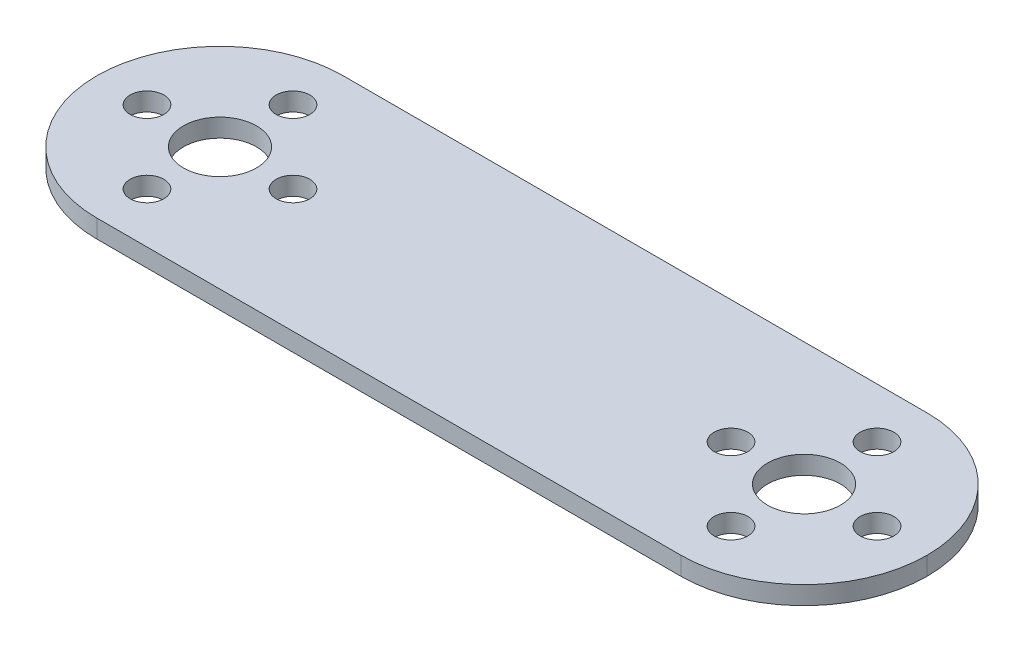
SolidWorks part; units mm, degrees
ref_plane "Front Plane" through (0, 0, 0) normal (0, 0, 1) x (1, 0, 0)
ref_plane "Top Plane" through (0, 0, 0) normal (0, 1, 0) x (1, 0, 0)
ref_plane "Right Plane" through (0, 0, 0) normal (1, 0, 0) x (0, 0, -1)
sketch "Sketch1" plane through (0, 0, 0) normal (0, 1, 0) x (1, 0, 0)
  line L1 (0, 0) -> (91, 0)
  line L2 (0, 0) -> (0, 27)
  line L3 (0, 27) -> (91, 27)
  line L4 (91, 0) -> (91, 27)
  dimension "D1" = 91
  dimension "D2" = 27
extrude "Extrude1" add sketch "Sketch1" along normal blind 2
sketch "Sketch2" plane through (0, 2, 0) normal (0, 1, 0) x (1, 0, 0)
  line L0 (91, 27) -> (0, 27) construction
  point P0 (45.5, 27)
  point P3 (45.5, 27)
  dimension "D1" = 32
  dimension "D2" = 13.5
  dimension "D3" = 32
sketch_block_instance "Block4-1"
sketch_block "Block4"
sketch_block_instance "Block4-2"
extrude "Cut-Extrude1" cut sketch "Sketch2" against normal blind 2
fillet "Fillet1" radius 13.5 1 edges at (91, 1, 0)
fillet "Fillet2" radius 13.5 1 edges at (91, 1, -27)
fillet "Fillet3" radius 13.5 1 edges at (0, 1, -27)
fillet "Fillet4" radius 13.5 1 edges at (0, 1, 0)
